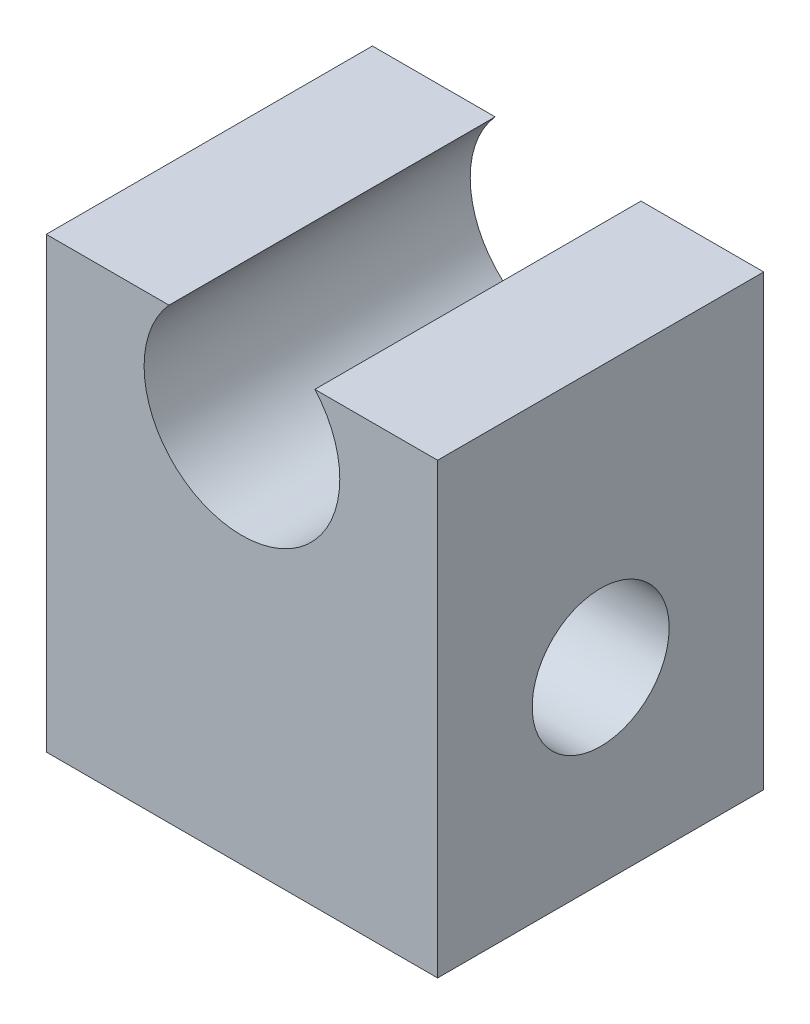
SolidWorks part; units mm, degrees
ref_plane "前视基准面" through (0, 0, 0) normal (0, 0, 1) x (1, 0, 0)
ref_plane "上视基准面" through (0, 0, 0) normal (0, 1, 0) x (1, 0, 0)
ref_plane "右视基准面" through (0, 0, 0) normal (1, 0, 0) x (0, 0, -1)
other "Configuration Table"
sketch "草图1" plane through (0, 0, 0) normal (0, 0, 1) x (1, 0, 0)
  line L1 (-12, -14) -> (12, -14)
  line L2 (-12, -14) -> (-12, 4)
  line L3 (-12, 4) -> (12, 4)
  line L4 (12, -14) -> (12, 4)
  line L5 (-12, -14) -> (12, 4) construction
  line L6 (-12, 4) -> (12, -14) construction
  point P0 (0, -5)
  dimension "D1" = 12
  dimension "D2" = 4
  dimension "D3" = 5
extrude "Slider_Nut_Block" add sketch "草图1" against normal mid plane 20
sketch "草图2" plane through (0, 0, 0) normal (1, 0, 0) x (0, 0, -1)
  circle A0 centre (0, -5) radius 4.2
  dimension "D1" = 8.4
  dimension "D2" = 5
extrude "Screw_Bore_D8p4" cut sketch "草图2" against normal mid plane 50
sketch "草图3" plane through (0, 0, 0) normal (0, 0, 1) x (1, 0, 0)
  line L0 (-12, -14) -> (12, -14) construction
  line L1 (-12, -23.5) -> (12, -23.5)
  line L2 (-12, -23.5) -> (-12, -4.5)
  line L3 (-12, -4.5) -> (12, -4.5)
  line L4 (12, -23.5) -> (12, -4.5)
  line L5 (-12, -23.5) -> (12, -4.5) construction
  line L6 (-12, -4.5) -> (12, -23.5) construction
  line L7 (12, -14) -> (12, 4) construction
  point P0 (0, -14)
  dimension "D1" = 4.5
extrude "Extend_Nut_Below_Axle" add sketch "草图3" against normal mid plane 20
sketch "草图4" plane through (0, 0, 0) normal (1, 0, 0) x (0, 0, -1)
  circle A0 centre (0, -5) radius 4.3
  dimension "D1" = 8.6
  dimension "D2" = 5
extrude "Close_Previous_Bore" add sketch "草图4" against normal mid plane 24
sketch "草图5" plane through (0, 0, 0) normal (1, 0, 0) x (0, 0, -1)
  circle A0 centre (0, -12) radius 4.2
  dimension "D1" = 8.4
  dimension "D2" = 12
extrude "Screw_Bore_Yminus12_D8p4" cut sketch "草图5" against normal mid plane 50
sketch "草图6" plane through (0, 0, 0) normal (0, 0, 1) x (1, 0, 0)
  circle A0 centre (0, 0) radius 6
  dimension "D1" = 12
extrude "Axle_Saddle_D12" cut sketch "草图6" against normal mid plane 50
